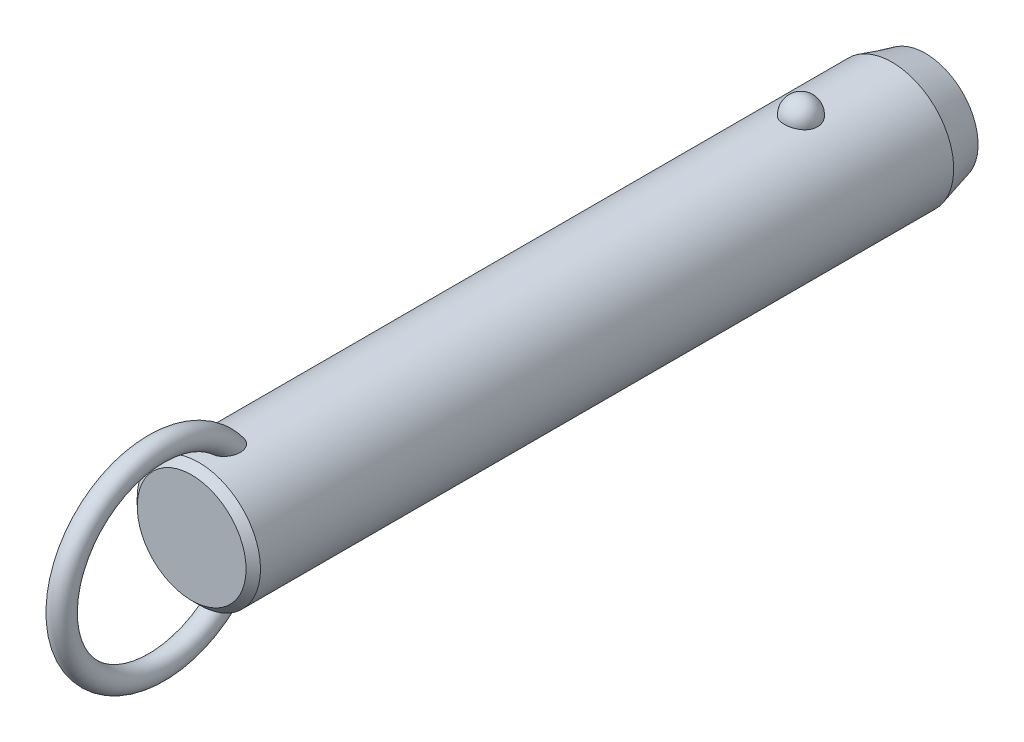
SolidWorks part; units mm, degrees
ref_plane "Front Plane" through (0, 0, 0) normal (0, 0, 1) x (1, 0, 0)
ref_plane "Top Plane" through (0, 0, 0) normal (0, 1, 0) x (1, 0, 0)
ref_plane "Right Plane" through (0, 0, 0) normal (1, 0, 0) x (0, 0, -1)
sketch "Sketch2" plane through (0, 0, 0) normal (0, 0, 1) x (1, 0, 0)
  circle A0 centre (0, 0) radius 11.1
  point P3 (0, 11.1)
  dimension "D1" = 22.2
extrude "Boss-Extrude1" add sketch "Sketch2" along normal blind 94
sketch "Sketch3" plane through (0, 0, 0) normal (0, 0, -1) x (-1, 0, 0)
  circle A0 centre (0, 0) radius 11.1
  dimension "D1" = 22.2
extrude "Boss-Extrude2" add sketch "Sketch3" along normal blind 25.4
chamfer "Chamfer1" distance 6 angle 15 1 edges at (-11.1, 0, -25.4)
sketch "Sketch12" plane through (0, 0, 0) normal (1, 0, 0) x (0, 0, -1)
  line L0 (-94, 11.1) -> (-94, -11.1) construction
  point P0 (-94, 0)
sketch "Sketch13" plane through (0, 0, 0) normal (1, 0, 0) x (0, 0, -1)
  circle A0 centre (-113.05, 0) radius 19.05
  point P2 (-94, 0)
  dimension "D1" = 38.1
sketch "Sketch14" plane through (0, 0, 0) normal (0, 1, 0) x (1, 0, 0)
  circle A0 centre (0, -96) radius 2
  point P2 (0, -94)
  dimension "D1" = 4
sweep "Sweep1" add profiles "Sketch14" path "Sketch13"
sketch "Sketch15" plane through (0, 0, 94) normal (0, 0, 1) x (1, 0, 0)
  circle A0 centre (0, 0) radius 11.1
  dimension "D1" = 22.2
extrude "Boss-Extrude3" add sketch "Sketch15" along normal blind 12.7
chamfer "Chamfer2" distance 1.3 angle 45 1 edges at (11.1, 0, 106.7)
sketch "Sketch18" plane through (0, 0, 0) normal (1, 0, 0) x (0, 0, -1)
  line L0 (19.4, 11.1) -> (-97.568, 11.1) construction
  line L1 (3, 14.1) -> (3, 8.1)
  line L2 (-97.568, -11.1) -> (19.4, -11.1) construction
  arc A0 (3, 14.1) -> (3, 8.1) centre (3, 11.1) ccw
  point P4 (0, 11.1)
  dimension "D1" = 25.2
revolve "Revolve1" add sketch "Sketch18" angle 360 about L1
